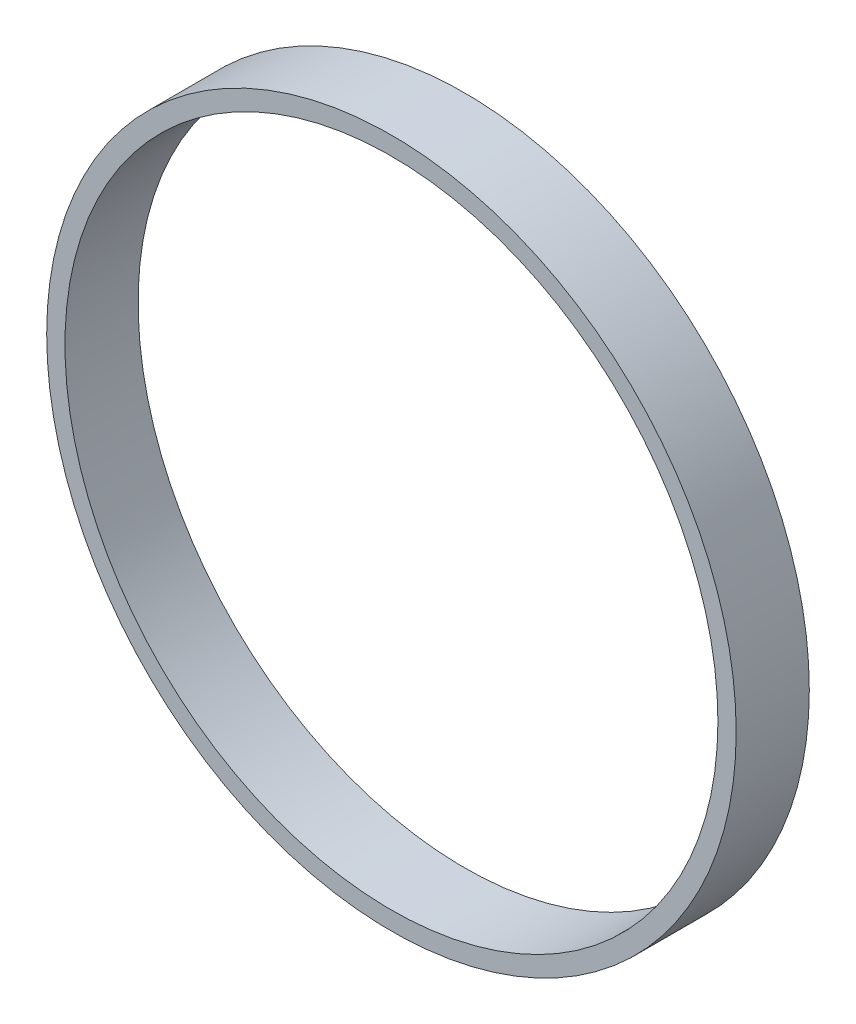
SolidWorks part; units mm, degrees
ref_plane "Front Plane" through (0, 0, 0) normal (0, 0, 1) x (1, 0, 0)
ref_plane "Top Plane" through (0, 0, 0) normal (0, 1, 0) x (1, 0, 0)
ref_plane "Right Plane" through (0, 0, 0) normal (1, 0, 0) x (0, 0, -1)
sketch "Sketch1" plane through (0, 0, 0) normal (0, 0, 1) x (1, 0, 0)
  circle A0 centre (0, 0) radius 33
  circle A1 centre (0, 0) radius 31.25
  dimension "D1" = 62.5
  dimension "D2" = 1.75
extrude "Boss-Extrude1" add sketch "Sketch1" along normal mid plane 7
